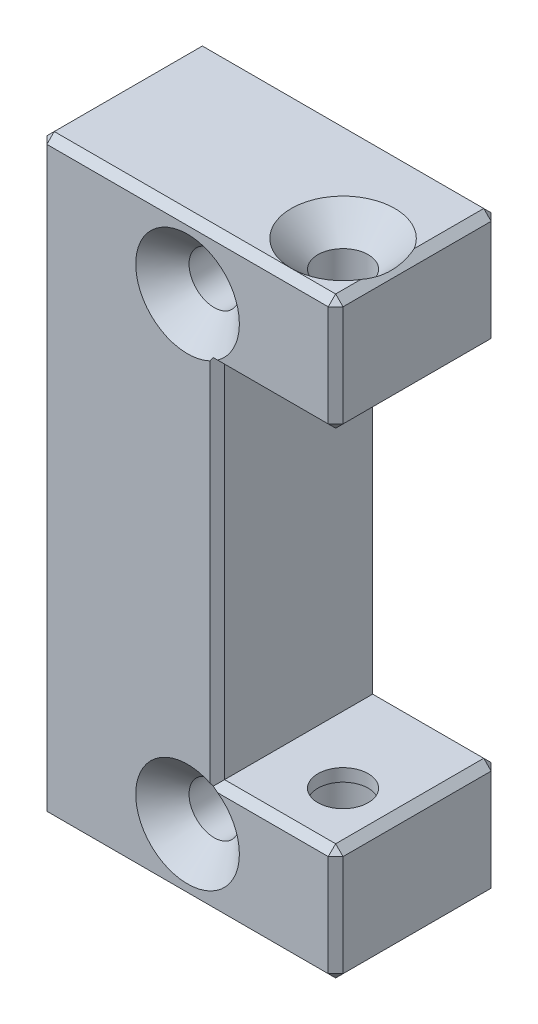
SolidWorks part; units mm, degrees
ref_plane "Ebene vorne" through (0, 0, 0) normal (0, 0, 1) x (1, 0, 0)
ref_plane "Ebene oben" through (0, 0, 0) normal (0, 1, 0) x (1, 0, 0)
ref_plane "Ebene rechts" through (0, 0, 0) normal (1, 0, 0) x (0, 0, -1)
sketch "Skizze1" plane through (0, 0, 0) normal (0, 0, 1) x (1, 0, 0)
  line L1 (-10, -20) -> (10, -20)
  line L2 (-10, -20) -> (-10, 20)
  line L3 (-10, 20) -> (10, 20)
  line L4 (10, -20) -> (10, 20)
  line L5 (-10, -20) -> (10, 20) construction
  line L6 (-10, 20) -> (10, -20) construction
  point P0 (0, 0)
  dimension "D1" = 20
  dimension "D2" = 40
extrude "Aufsatz-Linear austragen1" add sketch "Skizze1" along normal blind 11
sketch "Skizze2" plane through (0, 0, 11) normal (0, 0, 1) x (1, 0, 0)
  line L0 (10, -20) -> (10, 20) construction
  line L1 (10, 12.15) -> (2, 12.15)
  line L2 (10, 12.15) -> (10, -12.15)
  line L3 (10, -12.15) -> (2, -12.15)
  line L4 (2, 12.15) -> (2, -12.15)
  line L5 (0, 0) -> (2, 0) construction
  dimension "D1" = 24.3
  dimension "D2" = 8
extrude "Schnitt-Linear austragen1" cut sketch "Skizze2" against normal through all
hole_wizard "Formsenkung für M3 Senkschraube mit Innensechskant1" positions "Skizze3" profile "Skizze4" countersink size "M3" standard "DIN"
sketch "Skizze3" plane through (0, 0, 11) normal (0, 0, 1) x (1, 0, 0)
  line L0 (-10, 20) -> (-10, -20) construction
  line L1 (10, 20) -> (-10, 20) construction
  line L2 (-10, -20) -> (10, -20) construction
  point P0 (0, 15.5)
  point P2 (0, -15.5)
  dimension "D1" = 10
  dimension "D2" = 4.5
  dimension "D3" = 4.5
sketch "Skizze4" plane through (0, 15.5, 11) normal (1, 0, 0) x (0, -1, 0)
  line L0 (0, 0) -> (0, 11)
  line L1 (0, 11) -> (1.7, 11)
  line L2 (1.7, 11) -> (1.7, 1.8)
  line L3 (1.7, 1.8) -> (3.5, 0)
  line L5 (3.5, 0) -> (0, 0)
  line L6 (-1.7, 1.8) -> (-3.5, 0) construction
  line L11 (0, -6.35) -> (0, 107.95) construction
  dimension "Bohrerdurchmesser" = 3.4
  dimension "Bohrungstiefe" = 11
  dimension "Senkdurchmesser (Oben)" = 7
  dimension "Senkwinkel (Oben)" = 90
hole_wizard "Formsenkung für M3 Senkschraube mit Innensechskant2" positions "Skizze5" profile "Skizze6" countersink size "M3" standard "DIN"
sketch "Skizze5" plane through (0, 20, 0) normal (0, 1, 0) x (1, 0, 0)
  line L2 (10, -11) -> (10, 0) construction
  line L3 (10, -11) -> (-10, -11) construction
  point P0 (6.5, -7)
  dimension "D1" = 3.5
  dimension "D2" = 4
sketch "Skizze6" plane through (6.5, 20, 7) normal (1, 0, 0) x (0, 0, 1)
  line L0 (0, 0) -> (0, 40)
  line L1 (0, 40) -> (1.7, 40)
  line L2 (1.7, 40) -> (1.7, 1.8)
  line L3 (1.7, 1.8) -> (3.5, 0)
  line L5 (3.5, 0) -> (0, 0)
  line L6 (-1.7, 1.8) -> (-3.5, 0) construction
  line L11 (0, -6.35) -> (0, 107.95) construction
  dimension "Bohrerdurchmesser" = 3.4
  dimension "Bohrungstiefe" = 40
  dimension "Senkdurchmesser (Oben)" = 7
  dimension "Senkwinkel (Oben)" = 90
chamfer "Fase1" distance 0.5 angle 45 23 edges at (10, -16.075, 11) (10, 16.075, 11) (-10, 20, 5.5) (-10, 0, 11) (-10, -20, 5.5) (-10, 0, 0) (6, 12.15, 11) (2, 0, 11) (6, -12.15, 11) (10, -20, 5.5) (0, -20, 11) (0, 20, 11) (0, -20, 0) (10, -12.15, 5.5) (10, -16.075, 0) (6, -12.15, 0) (2, 0, 0) (10, 12.15, 5.5) (6, 12.15, 0) (0, 20, 0) (10, 16.075, 0) (10, 20, 9) (10, 20, 3.5)
sketch "Skizze8" plane through (0, -20, 0) normal (0, -1, 0) x (1, 0, 0)
  circle A0 centre (6.5, 7) radius 2
  dimension "D1" = 4
extrude "Schnitt-Linear austragen2" cut sketch "Skizze8" against normal blind 7
